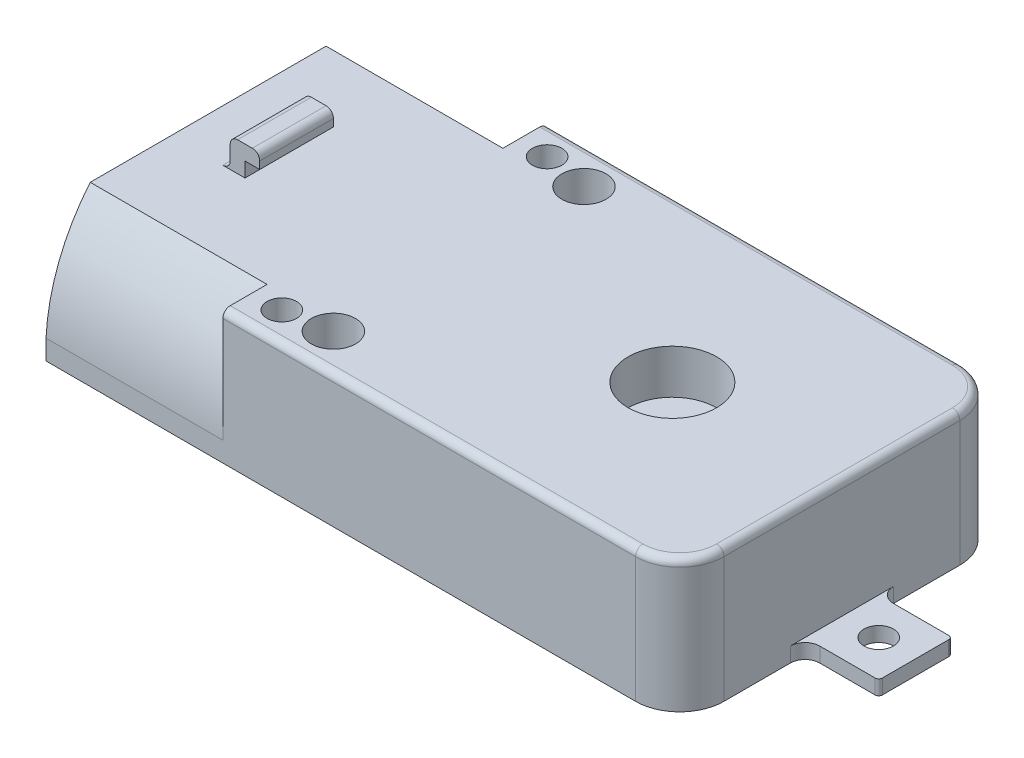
SolidWorks part; units mm, degrees
ref_plane "Front Plane" through (0, 0, 0) normal (0, 0, 1) x (1, 0, 0)
ref_plane "Top Plane" through (0, 0, 0) normal (0, 1, 0) x (1, 0, 0)
ref_plane "Right Plane" through (0, 0, 0) normal (1, 0, 0) x (0, 0, -1)
sketch "Sketch2" plane through (0, 0, 0) normal (0, 1, 0) x (1, 0, 0)
  line L0 (31, 11) -> (0, 11) construction
  line L1 (0, 0) -> (31, 0)
  line L2 (0, 0) -> (0, 22)
  line L3 (0, 22) -> (31, 22)
  line L4 (31, 0) -> (31, 22)
  line L7 (31, 8.5) -> (31, 13.5)
  dimension "48" = 31
  dimension "22" = 22
extrude "Boss-Extrude2" add sketch "Sketch2" along normal blind 9 contours L0 L7 L4 L3 L2 | L4 L0 L2 L1
sketch "Sketch4" plane through (31, 0, 0) normal (1, 0, 0) x (0, 0, -1)
  line L0 (0, 0) -> (22, 0) construction
  line L1 (8.5, 0) -> (13.5, 0)
  line L2 (8.5, 0) -> (8.5, 1)
  line L3 (8.5, 1) -> (13.5, 1)
  line L4 (13.5, 0) -> (13.5, 1)
  point P6 (11, 1)
  dimension "D1" = 1
  dimension "D2" = 5
  dimension "D3" = 11
extrude "Boss-Extrude3" add sketch "Sketch4" along normal blind 5
sketch "Sketch5" plane through (0, 1, 0) normal (0, 1, 0) x (1, 0, 0)
  circle A0 centre (33.5, 11) radius 1
  dimension "D1" = 2
  dimension "D2" = 2.5
  dimension "D3" = 2.5
extrude "Cut-Extrude1" cut sketch "Sketch5" against normal blind 5
fillet "Fillet1" radius 1 1 edges
fillet "Fillet2" radius 1 1 edges
fillet "Fillet3" radius 3 1 edges at (31, 4.5, 0)
fillet "Fillet4" radius 3 1 edges at (31, 4.5, -22)
sketch "Sketch6" plane through (0, 0, 0) normal (-1, 0, 0) x (0, 0, 1)
  line L0 (-11, 0) -> (-11, 9) construction
  line L1 (0, 0) -> (-22, 0) construction
  line L2 (0, 9) -> (-22, 9) construction
  line L3 (-22, 0) -> (0, 0)
  line L5 (-22, 0) -> (-22.0206, -0.0102)
  line L6 (0, 1.3449) -> (0, 0)
  line L7 (-19, 9) -> (-3, 9)
  line L8 (0, 0) -> (-22, 0)
  arc A0 (0, 0) -> (-3, 9) centre (-12.9826, 0.6725) ccw
  arc A1 (-22, 0) -> (-19, 9) centre (-9.0174, 0.6725) cw
  point P9 (0, 0)
  dimension "D1" = 13
  dimension "D2" = 3
sketch "Sketch7" plane through (0, 0, 0) normal (-1, 0, 0) x (0, 0, 1)
extrude "Boss-Extrude4" add sketch "Sketch6" along normal blind 12 contours L0 L7 A1 M1 M4 | L0 L8 A0 M2 M3
fillet "Fillet5" radius 0.5 5 edges at (14, 9, -22) (30.1213, 9, -21.1213) (31, 9, -11) (30.1213, 9, -0.8787) (14, 9, 0)
fillet "Fillet6" radius 0.25 2 edges at (36, 0.5, -13.5) (36, 0.5, -8.5)
sketch "Sketch8" plane through (0, 9, 0) normal (0, 1, 0) x (1, 0, 0)
  line L0 (30.5, 3) -> (30.5, 19) construction
  circle A0 centre (19.5, 11) radius 3
  point P2 (30.5, 11)
  dimension "D1" = 6
  dimension "D2" = 11
extrude "Cut-Extrude3" cut sketch "Sketch8" against normal blind 3
sketch "Sketch9" plane through (0, 6, 0) normal (0, 1, 0) x (1, 0, 0)
  circle A0 centre (19.5, 11) radius 0.75
  dimension "1,5" = 1.5
extrude "Cut-Extrude4" cut sketch "Sketch9" against normal blind 3
sketch "Sketch10" plane through (0, 9, 0) normal (0, 1, 0) x (1, 0, 0)
  line L0 (-12, 11) -> (30.5, 11) construction
  line L1 (-12, 3) -> (-12, 19) construction
  line L2 (30.5, 3) -> (30.5, 19) construction
  line L4 (28, 0) -> (0, 0) construction
  circle A0 centre (5, 19.5) radius 1.5
  circle A1 centre (5, 2.5) radius 1.5
  dimension "D1" = 3
  dimension "2,5" = 2.5
  dimension "5" = 5
extrude "Cut-Extrude7" cut sketch "Sketch10" against normal through all
sketch "Sketch12" plane through (0, 9, 0) normal (0, 1, 0) x (1, 0, 0)
  line L0 (28, 0) -> (0, 0) construction
  circle A0 centre (2, 2) radius 1
  circle A1 centre (2, 20) radius 1
  dimension "D1" = 2
  dimension "D2" = 2
  dimension "D3" = 2
  dimension "D4" = 2
  dimension "D5" = 2
  dimension "D6" = 2
extrude "Cut-Extrude8" cut sketch "Sketch12" against normal blind 5
sketch "Sketch13" plane through (0, 9, 0) normal (0, 1, 0) x (1, 0, 0)
  line L0 (-12, 11) -> (36, 11) construction
  line L1 (-8, 13.5) -> (-7, 13.5)
  line L2 (-8, 13.5) -> (-8, 8.5)
  line L3 (-8, 8.5) -> (-7, 8.5)
  line L4 (-7, 13.5) -> (-7, 8.5)
  line L5 (-12, 3) -> (-12, 19) construction
  line L6 (36, 13.25) -> (36, 8.75) construction
  dimension "D1" = 4
  dimension "D2" = 1
  dimension "D3" = 5
  dimension "D4" = 2.5
extrude "Boss-Extrude5" add sketch "Sketch13" along normal blind 2
sketch "Sketch14" plane through (-7, 0, 0) normal (1, 0, 0) x (0, 0, -1)
  line L0 (13.5, 11) -> (13.5, 9) construction
  line L1 (8.5, 11) -> (13.5, 11)
  line L2 (8.5, 11) -> (8.5, 10)
  line L3 (8.5, 10) -> (13.5, 10)
  line L4 (13.5, 11) -> (13.5, 10)
extrude "Boss-Extrude6" add sketch "Sketch14" along normal blind 1
fillet "Fillet7" radius 0.5 1 edges at (-8, 11, -11)
fillet "Fillet8" radius 0.5 1 edges at (-8, 9, -11)
fillet "Fillet9" radius 0.5 1 edges at (-6, 11, -11)
sketch "Sketch16" plane through (-12, 0, 0) normal (-1, 0, 0) x (0, 0, 1)
  line L0 (-18.2321, 8.3594) -> (-3.7679, 8.3594)
  line L1 (-21.0013, 1.2932) -> (-21, 0)
  line L2 (-0.9987, 1.2932) -> (-0.9987, 0)
  line L3 (-21, 0) -> (-0.9987, 0)
  arc A2 (-18.2321, 8.3594) -> (-21.0013, 1.2932) centre (-9.0174, 0.6725) ccw
  arc A3 (-18.2321, 8.3594) -> (-21.0013, 1.2932) centre (-9.0174, 0.6725) ccw
  arc A5 (-0.9987, 1.2932) -> (-3.7679, 8.3594) centre (-12.9826, 0.6725) ccw
  arc A6 (-0.9987, 1.2932) -> (-3.7679, 8.3594) centre (-12.9826, 0.6725) ccw
  dimension "D1" = 1
  dimension "D2" = 1
extrude "Cut-Extrude9" cut sketch "Sketch16" against normal blind 10
